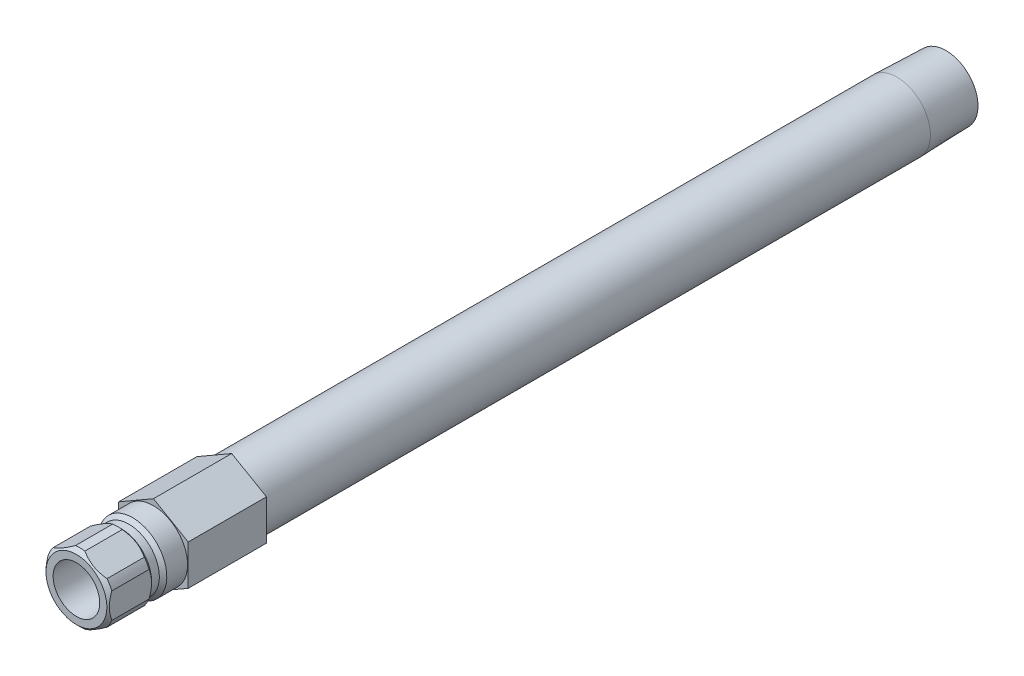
SolidWorks part; units mm, degrees
ref_plane "Front Plane" through (0, 0, 0) normal (0, 0, 1) x (1, 0, 0)
ref_plane "Top Plane" through (0, 0, 0) normal (0, 1, 0) x (1, 0, 0)
ref_plane "Right Plane" through (0, 0, 0) normal (1, 0, 0) x (0, 0, -1)
sketch "Sketch1" plane through (0, 0, 0) normal (1, 0, 0) x (0, 0, -1)
  line L0 (-12.8748, 0) -> (-18.923, 0) construction
  line L1 (-15.748, 4.7625) -> (-15.748, 6.223)
  line L2 (-6.604, 6.223) -> (-6.604, 0) construction
  line L3 (-14.986, 6.985) -> (-7.366, 6.985)
  line L4 (-3.556, 4.7625) -> (-3.556, 6.858) construction
  line L5 (-6.604, 6.223) -> (-5.0165, 6.223)
  line L6 (-4.2545, 6.985) -> (0, 6.985)
  line L7 (0, 6.985) -> (0, 6.858)
  line L8 (-6.604, 6.223) -> (-7.366, 6.985)
  line L9 (-5.0165, 6.223) -> (-4.2545, 6.985)
  line L10 (-15.748, 6.223) -> (-14.986, 6.985)
  line L11 (-15.748, 4.7625) -> (-3.556, 4.7625)
  line L12 (0, 6.858) -> (152.019, 6.858)
  line L13 (152.019, 6.858) -> (162.052, 6.5445)
  line L14 (162.052, 6.5445) -> (162.052, 4.6228)
  line L15 (-3.556, 4.7625) -> (-3.4817, 4.6228)
  line L16 (16.002, 6.858) -> (16.002, 0) construction
  line L17 (16.002, 0) -> (-12.8748, 0) construction
  line L19 (-3.4817, 4.6228) -> (162.052, 4.6228)
  dimension "D1" = 15.748
  dimension "D2" = 1.5875
  dimension "D3" = 0.762
  dimension "D4" = 45
  dimension "D5" = 9.144
  dimension "D6" = 45
  dimension "D7" = 1.79
  dimension "D8" = 10.033
  dimension "D9" = 177.8
  dimension "D10" = 3.175
  dimension "D11" = 9.525
  dimension "D12" = 13.716
  dimension "D13" = 31.75
  dimension "D14" = 13.97
  dimension "D15" = 9.2456
  dimension "D17" = 118
  dimension "D18" = 12.192
revolve "Revolve1" add sketch "Sketch1" angle 360 about L0
sketch "Sketch2" plane through (0, 0, 0) normal (0, 0, 1) x (1, 0, 0)
  line L1 (-7.112, 4.1061) -> (-7.112, -4.1061)
  line L2 (-7.112, -4.1061) -> (0, -8.2122)
  line L3 (0, -8.2122) -> (7.112, -4.1061)
  line L4 (7.112, -4.1061) -> (7.112, 4.1061)
  line L5 (7.112, 4.1061) -> (0, 8.2122)
  line L6 (0, 8.2122) -> (-7.112, 4.1061)
  circle A0 centre (0, 0) radius 7.112 construction
  circle A1 centre (0, 0) radius 4.6228 construction
  circle A2 centre (0, 0) radius 4.6228
  dimension "D1" = 14.224
extrude "Boss-Extrude1" add sketch "Sketch2" against normal up to vertex (16.002 mm away)
sketch "Sketch3" plane through (0, 0, 0) normal (0, 0, 1) x (1, 0, 0)
  line L1 (6.477, -3.7395) -> (6.477, 3.7395)
  line L2 (6.477, 3.7395) -> (0, 7.479)
  line L3 (0, 7.479) -> (-6.477, 3.7395)
  line L4 (-6.477, 3.7395) -> (-6.477, -3.7395)
  line L5 (-6.477, -3.7395) -> (0, -7.479)
  line L6 (0, -7.479) -> (6.477, -3.7395)
  circle A0 centre (0, 0) radius 6.477 construction
  dimension "D1" = 12.954
extrude "Cut-Extrude1" cut sketch "Sketch3" along normal through all from vertex at 6.604 flip side to cut
